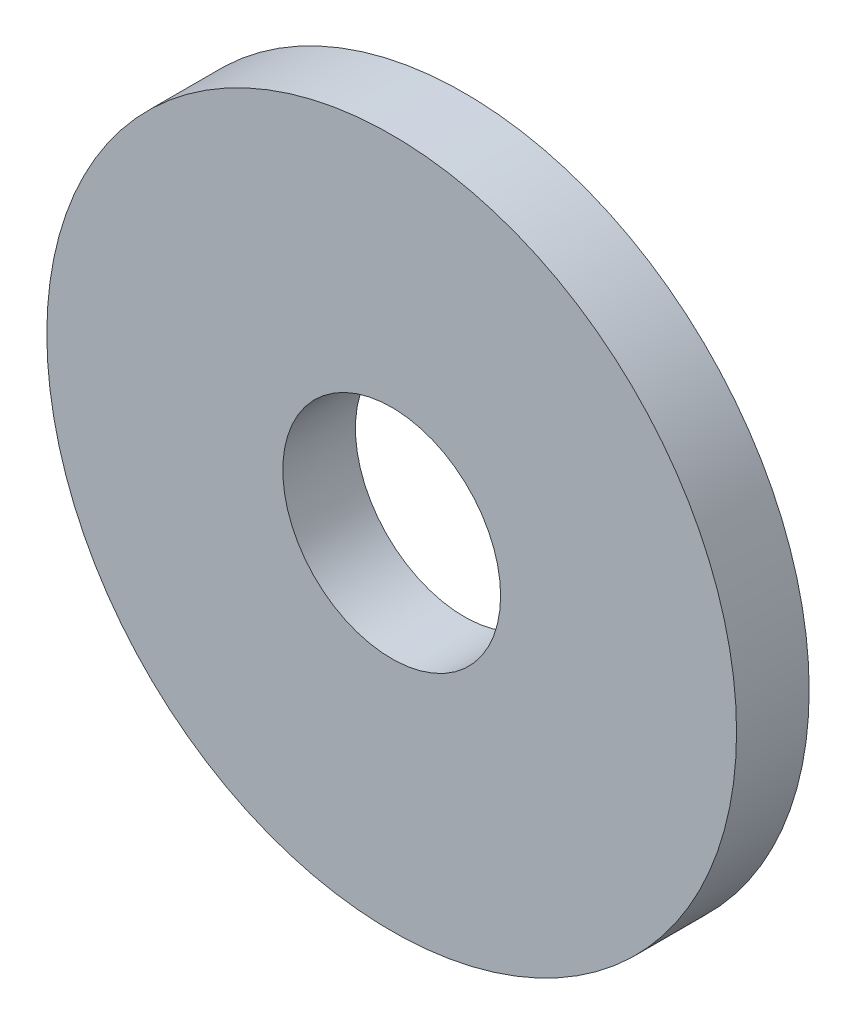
SolidWorks part; units mm, degrees
ref_plane "Plan de face" through (0, 0, 0) normal (0, 0, 1) x (1, 0, 0)
ref_plane "Plan de dessus" through (0, 0, 0) normal (0, 1, 0) x (1, 0, 0)
ref_plane "Plan de droite" through (0, 0, 0) normal (1, 0, 0) x (0, 0, -1)
sketch "Esquisse1" plane through (0, 0, 0) normal (0, 0, 1) x (1, 0, 0)
  circle A0 centre (0, 0) radius 4.75
  circle A1 centre (0, 0) radius 1.5
  dimension "D1" = 3
  dimension "D2" = 9.5
extrude "Extrusion1" add sketch "Esquisse1" along normal blind 1
